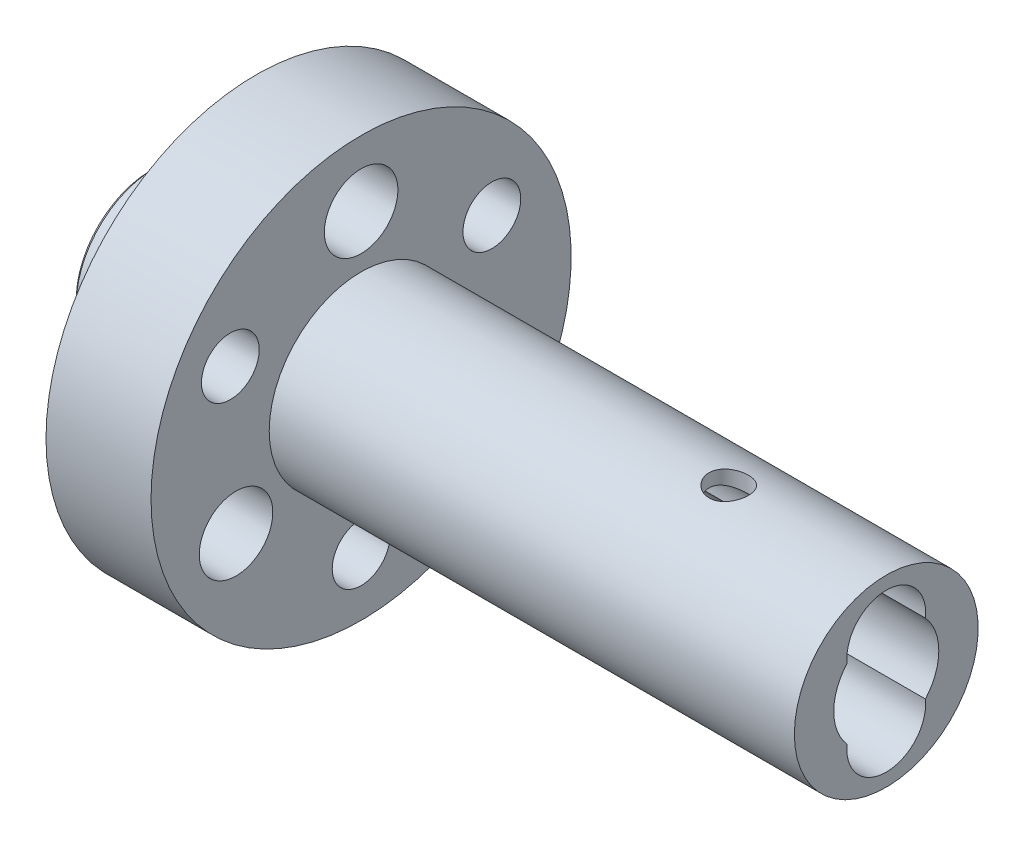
SolidWorks part; units mm, degrees
ref_plane "Vorne" through (0, 0, 0) normal (0, 0, 1) x (1, 0, 0)
ref_plane "Oben" through (0, 0, 0) normal (0, 1, 0) x (1, 0, 0)
ref_plane "Rechts" through (0, 0, 0) normal (1, 0, 0) x (0, 0, -1)
sketch "Skizze1" plane through (0, 0, 0) normal (0, 0, 1) x (1, 0, 0)
  line L0 (0, 0) -> (67.6406, 0) construction
  line L1 (0, 2.35) -> (1, 2.35)
  line L2 (1, 2.35) -> (1, 2)
  line L3 (1, 2) -> (28, 2)
  line L4 (28, 2) -> (28, 3.5)
  line L5 (28, 3.5) -> (8, 3.5)
  line L6 (8, 3.5) -> (8, 8)
  line L7 (8, 8) -> (4, 8)
  line L8 (4, 8) -> (4, 2.85)
  line L9 (4, 2.85) -> (3.2, 2.85)
  line L10 (3.2, 2.85) -> (3.2, 3.15)
  line L11 (3.2, 3.15) -> (0, 3.15)
  line L12 (0, 3.15) -> (0, 2.35)
  dimension "D1" = 4
  dimension "D2" = 4.7
  dimension "D3" = 0.3
  dimension "D4" = 6.3
  dimension "D5" = 0.8
  dimension "D6" = 1
  dimension "D7" = 4
  dimension "D8" = 28
  dimension "D9" = 20
  dimension "D10" = 16
  dimension "D11" = 7
revolve "Rotation1" add sketch "Skizze1" angle 360 about L0
hole_wizard "Ø2.8 (2.8) Durchmesser Bohrung1" positions "Skizze3" profile "Skizze2" hole size "Ø2.8" standard "ISO"
sketch "Skizze3" plane through (4, 0, 0) normal (-1, 0, 0) x (0, 0, 1)
  circle A0 centre (0, 0) radius 5.5 construction
  point P0 (0, 5.5)
  dimension "D1" = 11
sketch "Skizze2" plane through (4, 5.5, 0) normal (0, 1, 0) x (0, 0, 1)
  line L0 (0, 0) -> (0, 24)
  line L1 (0, 24) -> (1.4, 24)
  line L2 (1.4, 24) -> (1.4, 0)
  line L5 (1.4, 0) -> (0, 0)
  line L11 (0, -6.35) -> (0, 107.95) construction
  dimension "Bohrerdurchmesser" = 2.8
  dimension "Bohrungstiefe" = 24
hole_wizard "Ø2.2 (2.2) Durchmesser Bohrung1" positions "Skizze5" profile "Skizze4" hole size "Ø2.2" standard "ISO"
sketch "Skizze5" plane through (4, 0, 0) normal (-1, 0, 0) x (0, 0, 1)
  point P0 (0, -5.75)
  dimension "D1" = 5.75
sketch "Skizze4" plane through (4, -5.75, 0) normal (0, 1, 0) x (0, 0, 1)
  line L0 (0, 0) -> (0, 24)
  line L1 (0, 24) -> (1.1, 24)
  line L2 (1.1, 24) -> (1.1, 0)
  line L5 (1.1, 0) -> (0, 0)
  line L11 (0, -6.35) -> (0, 107.95) construction
  dimension "Bohrerdurchmesser" = 2.2
  dimension "Bohrungstiefe" = 24
pattern_circular "Kreismuster1" count 3 over 360 about axis through (0, 0, 0) along (1, 0, 0) of "Ø2.8 (2.8) Durchmesser Bohrung1", "Ø2.2 (2.2) Durchmesser Bohrung1"
sketch "Skizze6" plane through (0, 0, 0) normal (0, 1, 0) x (1, 0, 0)
  line L0 (28, 0) -> (1, 0) construction
  line L1 (28, -3.5) -> (28, 3.5) construction
  circle A0 centre (22, 0) radius 0.75
  dimension "D1" = 1.5
  dimension "D2" = 6
extrude "Linear austragen1" cut sketch "Skizze6" against normal mid plane 19
sketch "Skizze7" plane through (28, 0, 0) normal (1, 0, 0) x (0, 0, -1)
  arc A0 (1.4907, 1.3333) -> (-1.4907, 1.3333) centre (0, 1.5) ccw
  arc A1 (1.4907, -1.3333) -> (-1.4907, -1.3333) centre (0, -1.5) cw
  arc A2 (1.4907, -1.3333) -> (1.4907, 1.3333) centre (0, 0) ccw
  arc A3 (-1.4907, 1.3333) -> (-1.4907, -1.3333) centre (0, 0) ccw
  circle A4 centre (0, 0) radius 2 construction
  dimension "D1" = 3
  dimension "D2" = 1.5
  dimension "D3" = 1.5
extrude "Linear austragen2" cut sketch "Skizze7" against normal blind 10
chamfer "Fase1" distance 0.3 angle 45 1 edges at (0, 0, 3.15)
sketch "Skizze8" plane through (0, 0, 0) normal (-1, 0, 0) x (0, 0, 1)
  circle A0 centre (0, 0) radius 2.5
  dimension "D1" = 5
extrude "Linear austragen3" cut sketch "Skizze8" against normal blind 1
sketch "Skizze9" plane through (0, 0, 0) normal (-1, 0, 0) x (0, 0, 1)
  circle A0 centre (0, 0) radius 3
  dimension "D1" = 6
extrude "Linear austragen4" cut sketch "Skizze9" against normal blind 4 flip side to cut
